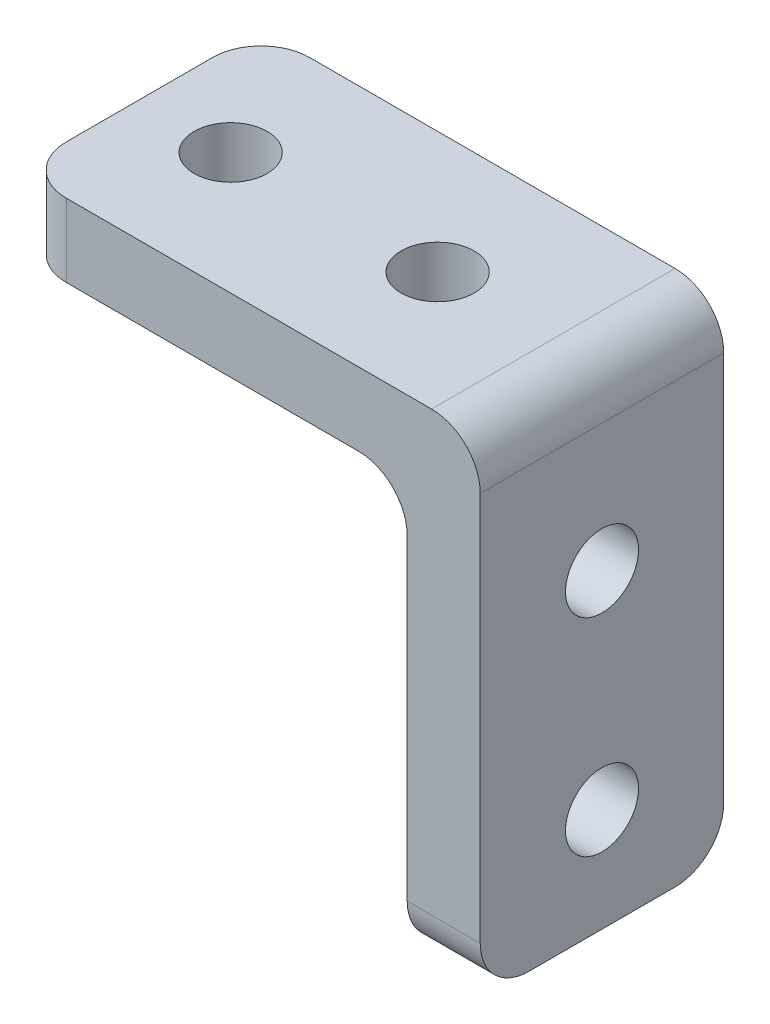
SolidWorks part; units mm, degrees
ref_plane "Front Plane" through (0, 0, 0) normal (0, 0, 1) x (1, 0, 0)
ref_plane "Top Plane" through (0, 0, 0) normal (0, 1, 0) x (1, 0, 0)
ref_plane "Right Plane" through (0, 0, 0) normal (1, 0, 0) x (0, 0, -1)
sketch "Sketch1" plane through (0, 0, 0) normal (0, 1, 0) x (1, 0, 0)
  line L0 (-8, 0) -> (8, 0) construction
  line L1 (8, -5) -> (-8, -5)
  line L2 (8, -5) -> (8, 5)
  line L3 (8, 5) -> (-8, 5)
  line L4 (-8, -5) -> (-8, 5)
  line L5 (8, -5) -> (-8, 5) construction
  line L6 (8, 5) -> (-8, -5) construction
  line L7 (0, 5) -> (0, -5) construction
  line L8 (0, 5) -> (0, -5) construction
  line L9 (0, 5) -> (8, 5) construction
  line L10 (4, 5) -> (4, -5) construction
  circle A0 centre (4.25, 0) radius 1.5
  circle A1 centre (-4.25, 0) radius 1.5
  point P0 (0, 0)
  dimension "D2" = 3
  dimension "D1" = 16
  dimension "10" = 10
  dimension "D3" = 3.75
extrude "Boss-Extrude1" add sketch "Sketch1" along normal blind 3
sketch "Sketch2" plane through (0, 3, 0) normal (0, 1, 0) x (1, 0, 0)
  line L1 (8, 5) -> (11, 5)
  line L2 (8, 5) -> (8, -5)
  line L3 (8, -5) -> (11, -5)
  line L4 (11, 5) -> (11, -5)
  dimension "D1" = 10
  dimension "D2" = 3
extrude "Boss-Extrude2" add sketch "Sketch2" against normal blind 20
sketch "Sketch3" plane through (8, 0, 0) normal (-1, 0, 0) x (0, 0, 1)
  line L0 (0, 0) -> (0, -17) construction
  line L1 (-5, -17) -> (5, -17) construction
  line L2 (-5, 0) -> (-5, -17) construction
  line L3 (-5, -8.5) -> (5, -8.5) construction
  line L4 (5, -17) -> (5, 0) construction
  line L5 (5, -8.5) -> (5, -17) construction
  line L6 (5, -17) -> (5, -12.75) construction
  line L7 (5, -12.75) -> (-5, -12.75) construction
  circle A0 centre (0, -12.75) radius 1.5
  circle A1 centre (0, -4.25) radius 1.5
  dimension "D1" = 3
extrude "Cut-Extrude1" cut sketch "Sketch3" against normal blind 20
fillet "Fillet1" radius 2 6 edges at (9.5, -17, -5) (9.5, -17, 5) (11, 3, 0) (-8, 1.5, -5) (-8, 1.5, 5)
